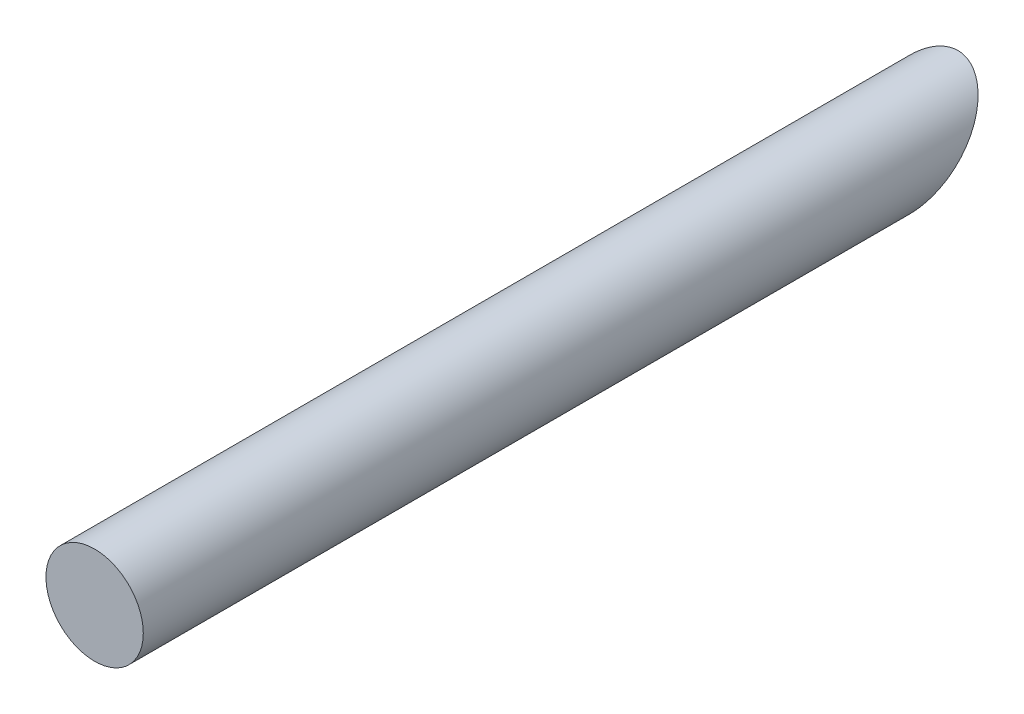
SolidWorks part; units mm, degrees
ref_plane "Plan1" through (0, 0, 0) normal (0, 0, 1) x (1, 0, 0)
ref_plane "Plan2" through (0, 0, 0) normal (0, 1, 0) x (1, 0, 0)
ref_plane "Plan3" through (0, 0, 0) normal (1, 0, 0) x (0, 0, -1)
sketch "Esquisse1" plane through (0, 0, 0) normal (0, 0, 1) x (1, 0, 0)
  circle A0 centre (0, 0) radius 3.1
  dimension "D1" = 6.2
extrude "Extrusion1" add sketch "Esquisse1" along normal blind 55
sketch "Esquisse2" plane through (0, 0, 0) normal (1, 0, 0) x (0, 0, -1)
  line L0 (-8.4372, -5.3372) -> (1.4672, 4.5672)
  line L1 (1.4672, 4.5672) -> (1.4672, -5.3372)
  line L2 (1.4672, -5.3372) -> (-8.4372, -5.3372)
  dimension "D1" = 45
extrude "Enlèv. mat.-Extru.1" cut sketch "Esquisse2" against normal mid plane 10
